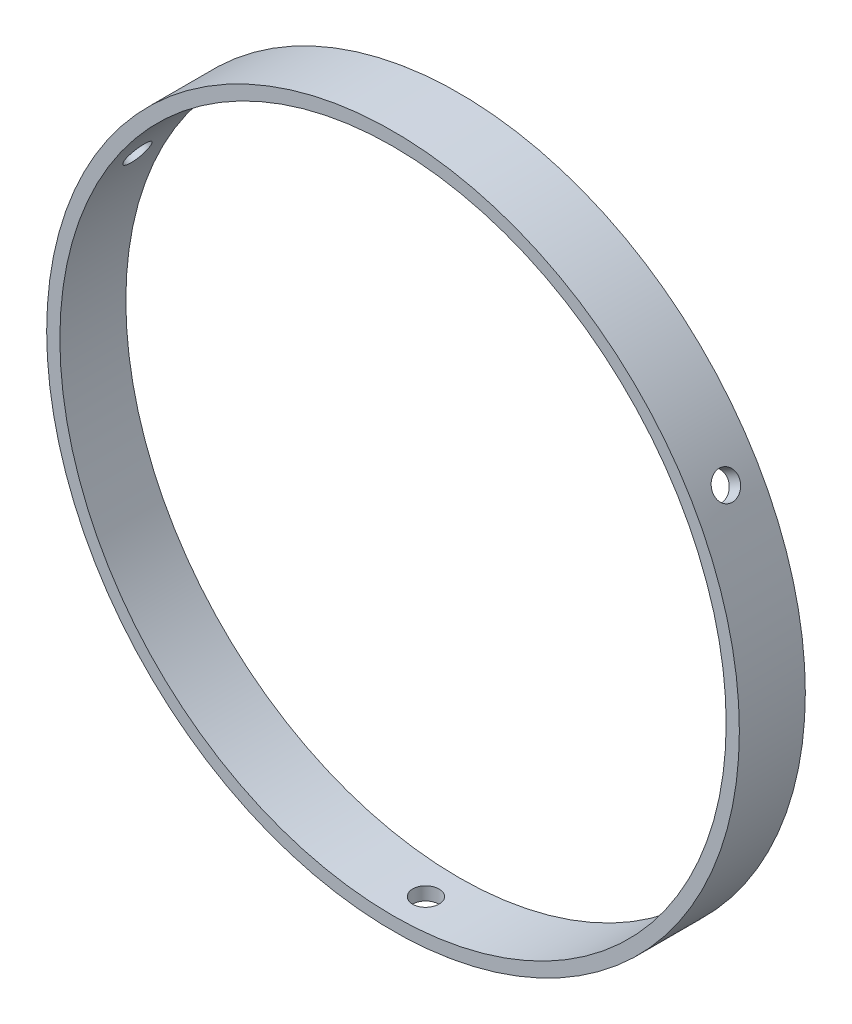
SolidWorks part; units mm, degrees
ref_plane "Plan de face" through (0, 0, 0) normal (0, 0, 1) x (1, 0, 0)
ref_plane "Plan de dessus" through (0, 0, 0) normal (0, 1, 0) x (1, 0, 0)
ref_plane "Plan de droite" through (0, 0, 0) normal (1, 0, 0) x (0, 0, -1)
sketch "Esquisse1" plane through (0, 0, 0) normal (0, 0, 1) x (1, 0, 0)
  circle A0 centre (0, 0) radius 50.5
  circle A1 centre (0, 0) radius 52.5
  dimension "D1" = 101
  dimension "D2" = 2
extrude "Boss.-Extru.1" add sketch "Esquisse1" along normal mid plane 10
sketch "Esquisse2" plane through (0, 0, 0) normal (0, 1, 0) x (1, 0, 0)
  circle A0 centre (0, 0) radius 2
  dimension "D1" = 4
extrude "Enlèv. mat.-Extru.1" cut sketch "Esquisse2" against normal through all
pattern_circular "Répétition circulaire1" count 3 over 360 about axis through (0, 0, 5) along (0, 0, -1) of "Enlèv. mat.-Extru.1"
